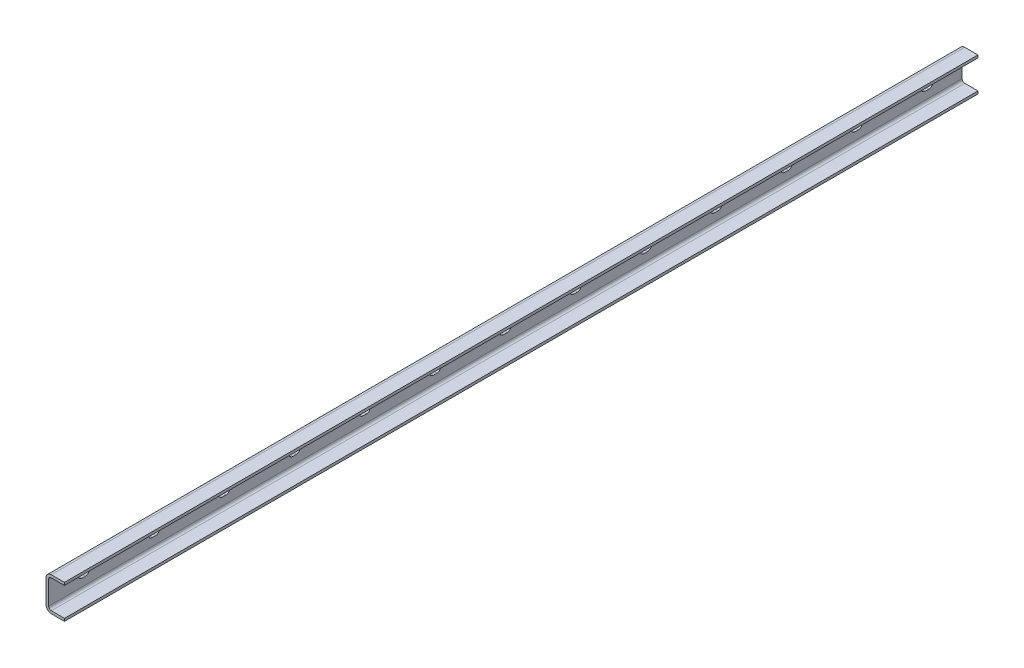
SolidWorks part; units mm, degrees
ref_plane "Front Plane" through (0, 0, 0) normal (0, 0, 1) x (1, 0, 0)
ref_plane "Top Plane" through (0, 0, 0) normal (0, 1, 0) x (1, 0, 0)
ref_plane "Right Plane" through (0, 0, 0) normal (1, 0, 0) x (0, 0, -1)
sketch "Sketch1" plane through (0, 0, 0) normal (0, 0, 1) x (1, 0, 0)
  line L0 (21, 16.25) -> (21, 19.25)
  line L1 (21, 19.25) -> (6, 19.25)
  line L2 (0, 13.25) -> (0, 0)
  line L3 (0, 0) -> (0, -13.25)
  line L4 (6, -19.25) -> (21, -19.25)
  line L5 (21, -19.25) -> (21, -16.25)
  line L6 (21, -16.25) -> (6, -16.25)
  line L7 (3, -13.25) -> (3, 13.25)
  line L8 (6, 16.25) -> (21, 16.25)
  arc A0 (6, 19.25) -> (0, 13.25) centre (6, 13.25) ccw
  arc A1 (0, -13.25) -> (6, -19.25) centre (6, -13.25) ccw
  arc A2 (6, -16.25) -> (3, -13.25) centre (6, -13.25) cw
  arc A3 (3, 13.25) -> (6, 16.25) centre (6, 13.25) cw
  dimension "D1" = 6
  dimension "D2" = 21
  dimension "D3" = 16.25
extrude "Boss-Extrude1" add sketch "Sketch1" against normal blind 1040 contours L7 A3 L8 L0 L1 A0 L2 L3 A1 L4 L5 L6 A2
sketch "Sketch2" plane through (3, 0, 0) normal (1, 0, 0) x (0, 0, -1)
  line L0 (38, 0) -> (42, 0) construction
  line L1 (38, 4.5) -> (42, 4.5)
  line L2 (38, -4.5) -> (42, -4.5)
  arc A0 (38, 4.5) -> (38, -4.5) centre (38, 0) ccw
  arc A1 (42, -4.5) -> (42, 4.5) centre (42, 0) ccw
  point P2 (40, 0)
  point P8 (40, -4.5)
  point P9 (40, 4.5)
  dimension "D1" = 4
  dimension "D2" = 9
  dimension "D3" = 40
extrude "Cut-Extrude1" cut sketch "Sketch2" against normal through all
pattern_linear "LPattern1" count 13 spacing 80 along (0, 0, -1) of "Cut-Extrude1"
